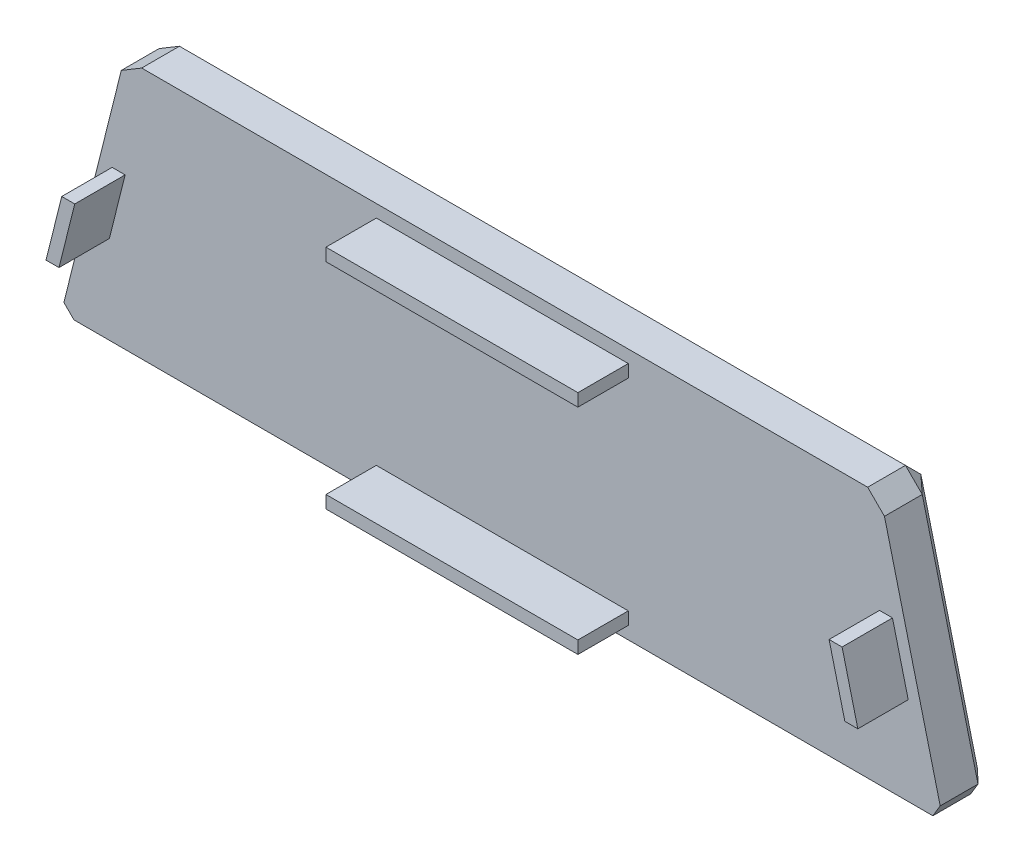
SolidWorks part; units mm, degrees
ref_plane "Plan de face" through (0, 0, 0) normal (0, 0, 1) x (1, 0, 0)
ref_plane "Plan de dessus" through (0, 0, 0) normal (0, 1, 0) x (1, 0, 0)
ref_plane "Plan de droite" through (0, 0, 0) normal (1, 0, 0) x (0, 0, -1)
sketch "Esquisse1" plane through (0, 0, 0) normal (0, 0, 1) x (1, 0, 0)
  line L0 (-17.5, 0) -> (17.5, 0)
  line L1 (-17.5, 0) -> (-17.5, 7.5)
  line L2 (-17.5, 7.5) -> (-15, 17.5)
  line L3 (-15, 17.5) -> (15, 17.5)
  line L4 (15, 17.5) -> (17.5, 7.5)
  line L5 (17.5, 7.5) -> (17.5, 0)
  line L6 (-17.5, 7.5) -> (17.5, 7.5)
  point P5 (0, 17.5)
  dimension "D1" = 30
  dimension "D2" = 7.5
  dimension "D3" = 35
  dimension "D4" = 10
extrude "Boss.-Extru.1" add sketch "Esquisse1" against normal blind 2 contours L2 L6 L4 L3
sketch "Esquisse3" plane through (0, 0, 0) normal (0, 0, 1) x (1, 0, 0)
  line L0 (-14.6096, 17) -> (-16.8596, 8)
  line L1 (-16.8596, 8) -> (16.8596, 8)
  line L2 (16.8596, 8) -> (14.6096, 17)
  line L3 (14.6096, 17) -> (-14.6096, 17)
  line L4 (-17.5, 7.5) -> (-15, 17.5) construction
  line L5 (-15, 17.5) -> (15, 17.5) construction
  line L6 (-17.5, 7.5) -> (17.5, 7.5) construction
  line L7 (15, 17.5) -> (17.5, 7.5) construction
  line L8 (-15, 17.5) -> (-17.5, 7.5)
  line L9 (-17.5, 7.5) -> (17.5, 7.5)
  line L10 (17.5, 7.5) -> (15, 17.5)
  line L11 (15, 17.5) -> (-15, 17.5)
  line L12 (-16.2192, 8.5) -> (16.2192, 8.5)
  line L13 (16.2192, 8.5) -> (14.2192, 16.5)
  line L14 (14.2192, 16.5) -> (-14.2192, 16.5)
  line L15 (-14.2192, 16.5) -> (-16.2192, 8.5)
  line L16 (0, 0) -> (0, 28.2985) construction
  line L17 (-5, 17) -> (-5, 16.5)
  line L18 (-5, 16.5) -> (5, 16.5)
  line L19 (5, 16.5) -> (5, 17)
  line L20 (5, 17) -> (-5, 17)
  line L21 (-5, 8.5) -> (-5, 8)
  line L22 (-5, 8) -> (5, 8)
  line L23 (5, 8) -> (5, 8.5)
  line L24 (5, 8.5) -> (-5, 8.5)
  line L25 (-16.1096, 11) -> (-15.5942, 11)
  line L26 (-15.4846, 13.5) -> (-14.9692, 13.5)
  line L27 (15.4846, 13.5) -> (14.9692, 13.5)
  line L28 (16.1096, 11) -> (15.5942, 11)
  dimension "D4" = 10
  dimension "D5" = 5
  dimension "D6" = 2.5
  dimension "D7" = 4
  dimension "D2" = 0.5
  dimension "D3" = 0.5
extrude "Boss.-Extru.2" add sketch "Esquisse3" along normal blind 2 contours L26 L0 L25 L15 | L18 L16 L20 L17 | L16 L14 L19 L3 | L1 L16 L12 L21 | L16 L22 L23 L24 | L28 L2 L27 L13
chamfer "Chanfrein1" distance 0.5 angle 45 8 edges at (-15, 17.5, -1) (15, 17.5, -1) (0, 7.5, -2) (16.25, 12.5, -2) (0, 17.5, -2) (-16.25, 12.5, -2) (17.5, 7.5, -1) (-17.5, 7.5, -1)
